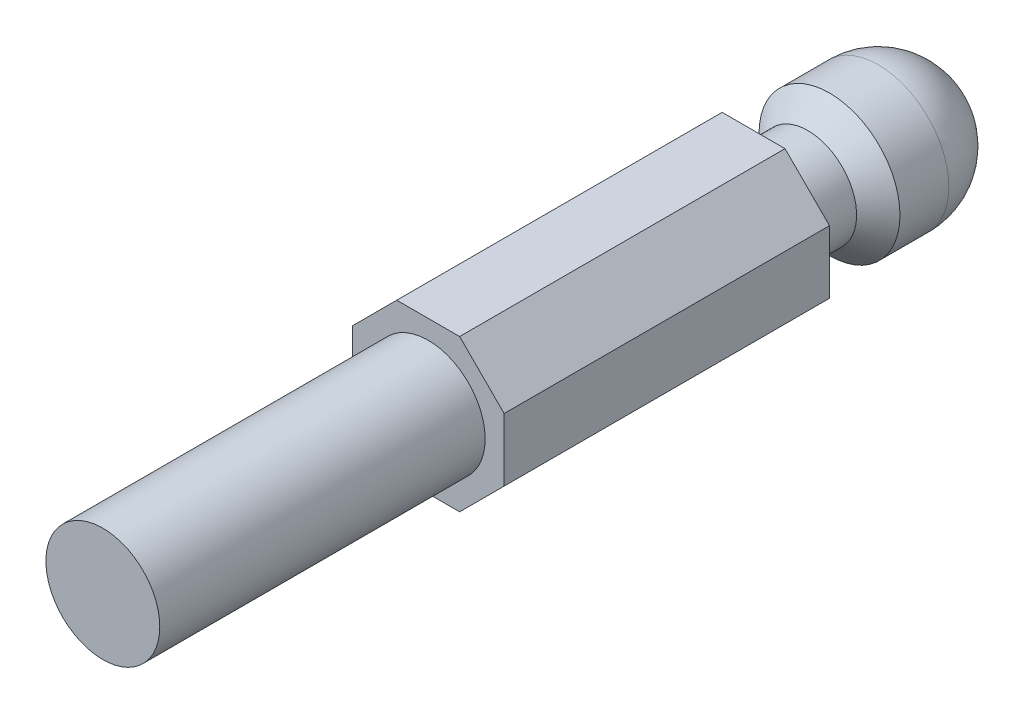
SolidWorks part; units mm, degrees
ref_plane "Plan de face" through (0, 0, 0) normal (0, 0, 1) x (1, 0, 0)
ref_plane "Plan de dessus" through (0, 0, 0) normal (0, 1, 0) x (1, 0, 0)
ref_plane "Plan de droite" through (0, 0, 0) normal (1, 0, 0) x (0, 0, -1)
sketch "Esquisse1" plane through (0, 0, 0) normal (0, 0, 1) x (1, 0, 0)
  line L0 (-7, 2.8995) -> (-7, -2.8995)
  line L1 (-7, -2.8995) -> (-2.8995, -7)
  line L2 (-2.8995, -7) -> (2.8995, -7)
  line L3 (2.8995, -7) -> (7, -2.8995)
  line L4 (7, -2.8995) -> (7, 2.8995)
  line L5 (7, 2.8995) -> (2.8995, 7)
  line L6 (2.8995, 7) -> (-2.8995, 7)
  line L7 (-2.8995, 7) -> (-7, 2.8995)
  point P8 (0, -7)
  point P9 (0, 7)
  point P11 (7, 0)
  point P12 (-7, 0)
  dimension "D1" = 14
  dimension "D2" = 14
extrude "Boss.-Extru.1" add sketch "Esquisse1" along normal blind 30
sketch "Esquisse2" plane through (0, 0, 0) normal (0, 0, -1) x (-1, 0, 0)
  circle A0 centre (0, 0) radius 4.5
  point P2 (0, 0)
  dimension "D1" = 9
extrude "Boss.-Extru.2" add sketch "Esquisse2" along normal blind 7
sketch "Esquisse3" plane through (0, 0, -7) normal (0, 0, -1) x (-1, 0, 0)
  circle A0 centre (0, 0) radius 6.5
  dimension "D1" = 13
extrude "Boss.-Extru.3" add sketch "Esquisse3" along normal blind 11
chamfer "Chanfrein1" distance 2 angle 45 1 edges at (-4.5, 0, -7)
fillet "Congé1" radius 6.5 1 edges at (-6.5, 0, -18)
sketch "Esquisse4" plane through (0, 0, 30) normal (0, 0, 1) x (1, 0, 0)
  circle A0 centre (0, 0) radius 5.25
  dimension "D1" = 10.5
extrude "Boss.-Extru.4" add sketch "Esquisse4" along normal blind 30
